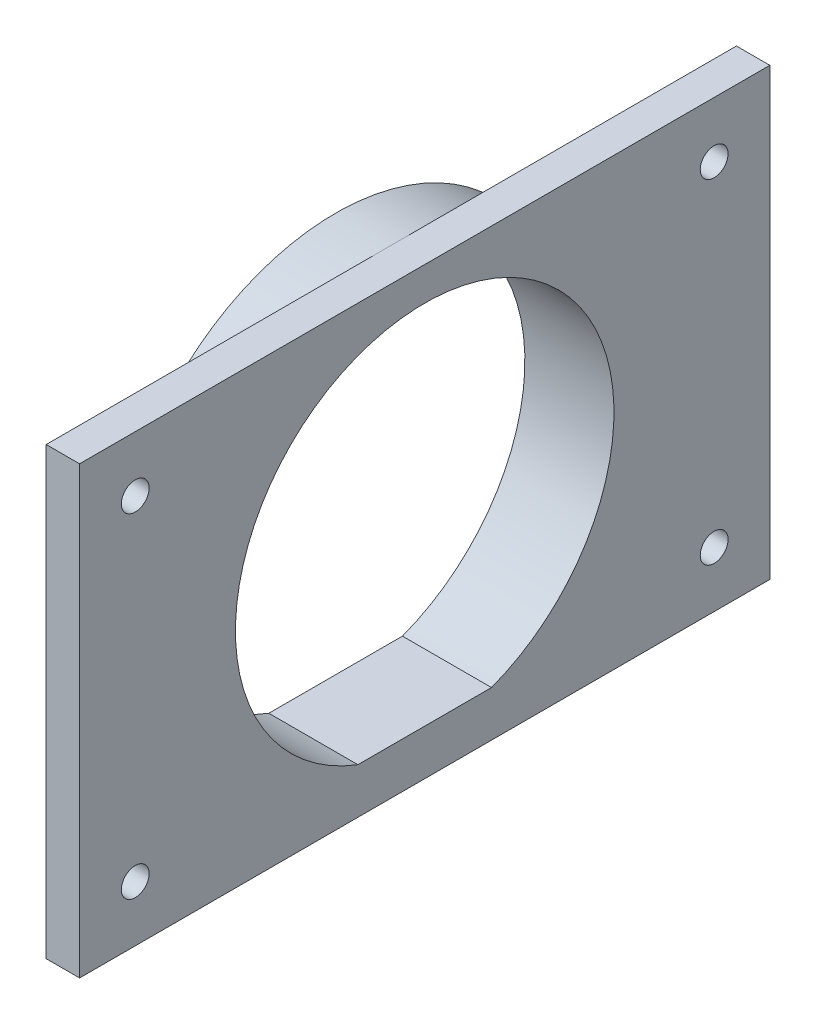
SolidWorks part; units mm, degrees
ref_plane "Front Plane" through (0, 0, 0) normal (0, 0, 1) x (1, 0, 0)
ref_plane "Top Plane" through (0, 0, 0) normal (0, 1, 0) x (1, 0, 0)
ref_plane "Right Plane" through (0, 0, 0) normal (1, 0, 0) x (0, 0, -1)
sketch "Esquisse6" plane through (0, 0, 0) normal (1, 0, 0) x (0, 0, -1)
  line L1 (-31, -20) -> (31, -20)
  line L2 (-31, -20) -> (-31, 20)
  line L3 (-31, 20) -> (31, 20)
  line L4 (31, -20) -> (31, 20)
  line L5 (-31, -20) -> (31, 20) construction
  line L6 (-31, 20) -> (31, -20) construction
  point P0 (0, 0)
  dimension "D1" = 40
  dimension "D2" = 62
extrude "Boss.-Extru.3" add sketch "Esquisse6" against normal blind 3
sketch "Esquisse11" plane through (0, 0, 0) normal (-1, 0, 0) x (0, 0, 1)
  circle A0 centre (0, 0) radius 20
extrude "Boss.-Extru.4" add sketch "Esquisse11" along normal blind 8
sketch "Esquisse12" plane through (-8, 0, 0) normal (-1, 0, 0) x (0, 0, 1)
  line L0 (6, -15.906) -> (-6, -15.906)
  arc A0 (6, -15.906) -> (-6, -15.906) centre (0, 0) ccw
  point P5 (0, -15.906)
  dimension "D1" = 34
  dimension "D2" = 12
extrude "Enlèv. mat.-Extru.2" cut sketch "Esquisse12" against normal through all
sketch "Esquisse14" plane through (-3, 0, 0) normal (-1, 0, 0) x (0, 0, 1)
  line L0 (-31, -20) -> (-31, 20) construction
  line L1 (-31, 20) -> (0, 20) construction
  line L2 (-26, 15) -> (26, 15) construction
  line L3 (-26, 15) -> (-26, -15) construction
  circle A0 centre (-26, 15) radius 1.25
  circle A1 centre (26, 15) radius 1.25
  circle A2 centre (26, -15) radius 1.25
  circle A3 centre (-26, -15) radius 1.25
  point P8 (0, 15)
  point P9 (-26, 0)
extrude "Enlèv. mat.-Extru.4" cut sketch "Esquisse14" against normal through all
chamfer "Chanfrein1" distance 1 angle 45 4 edges at (-3, -15, 27.25) (-3, -15, -24.75) (-3, 15, 27.25) (-3, 15, -24.75)
equation "\"D3@Esquisse14\"=\"D2@Esquisse14\""
